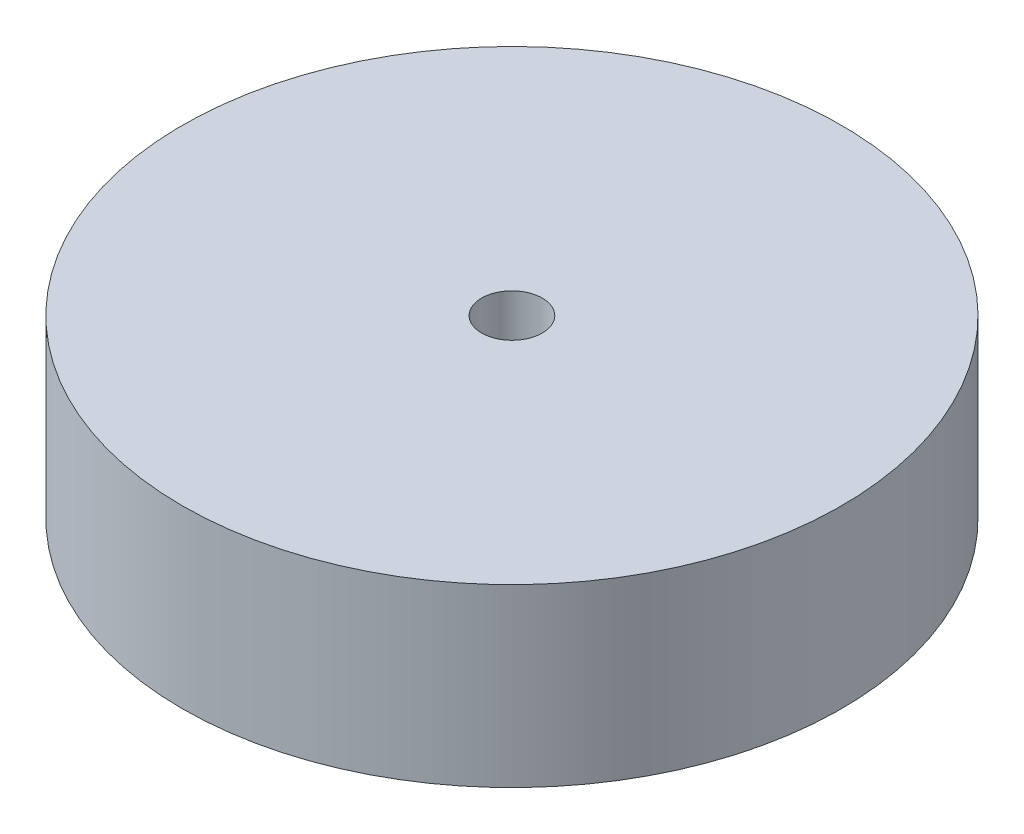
SolidWorks part; units mm, degrees
ref_plane "Front Plane" through (0, 0, 0) normal (0, 0, 1) x (1, 0, 0)
ref_plane "Top Plane" through (0, 0, 0) normal (0, 1, 0) x (1, 0, 0)
ref_plane "Right Plane" through (0, 0, 0) normal (1, 0, 0) x (0, 0, -1)
sketch "Sketch1" plane through (0, 0, 0) normal (0, 1, 0) x (1, 0, 0)
  circle A0 centre (0, 0) radius 19.05
  dimension "D1" = 38.1
extrude "Extrude1" add sketch "Sketch1" along normal blind 10.16
sketch "Sketch2" plane through (0, 10.16, 0) normal (0, 1, 0) x (-1, 0, 0)
  point P0 (0, 0)
hole_wizard "#6-32 Tapped Hole2" positions "3DSketch3" profile "Sketch5" tap size "#6-32" standard "Ansi Inch"
sketch3d "3DSketch3"
  point P0 (0, 10.16, 0)
sketch "Sketch5" plane through (0, 10.16, 0) normal (1, 0, 0) x (0, 0, 1)
  line L0 (0, 0) -> (0, 8.6867)
  line L1 (0, 8.6867) -> (1.3525, 7.874)
  line L2 (1.3525, 7.874) -> (1.3525, 7.112)
  line L3 (1.3525, 7.112) -> (1.7526, 7.112)
  line L4 (1.7526, 7.112) -> (1.7526, 0)
  line L5 (1.7526, 0) -> (0, 0)
  line L10 (0, 8.6867) -> (-1.3526, 7.874) construction
  line L11 (0, -6.35) -> (0, 107.95) construction
  dimension "Tap Drill Dia." = 2.7051
  dimension "Tap Drill Depth" = 7.874
  dimension "Thread Major Dia." = 3.5052
  dimension "Thread Depth" = 7.112
  dimension "Drill Angle" = 118
